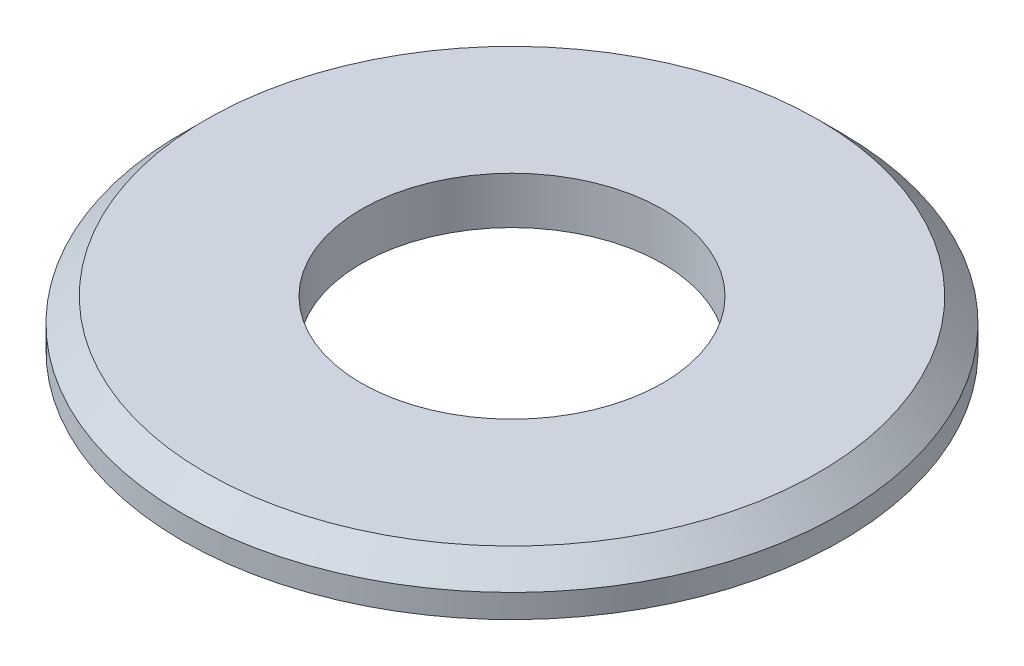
SolidWorks part; units mm, degrees
ref_plane "Front" through (0, 0, 0) normal (0, 0, 1) x (1, 0, 0)
ref_plane "Top" through (0, 0, 0) normal (0, 1, 0) x (1, 0, 0)
ref_plane "Right" through (0, 0, 0) normal (1, 0, 0) x (0, 0, -1)
sketch "Sketch1" plane through (0, 0, 0) normal (0, 1, 0) x (1, 0, 0)
  circle A0 centre (0, 0) radius 1.6
  circle A1 centre (0, 0) radius 3.5
extrude "Extrude1" add sketch "Sketch1" along normal blind 0.5
chamfer "Chamfer1" distance 0.25 1 edges at (0, 0.5, 3.5)
